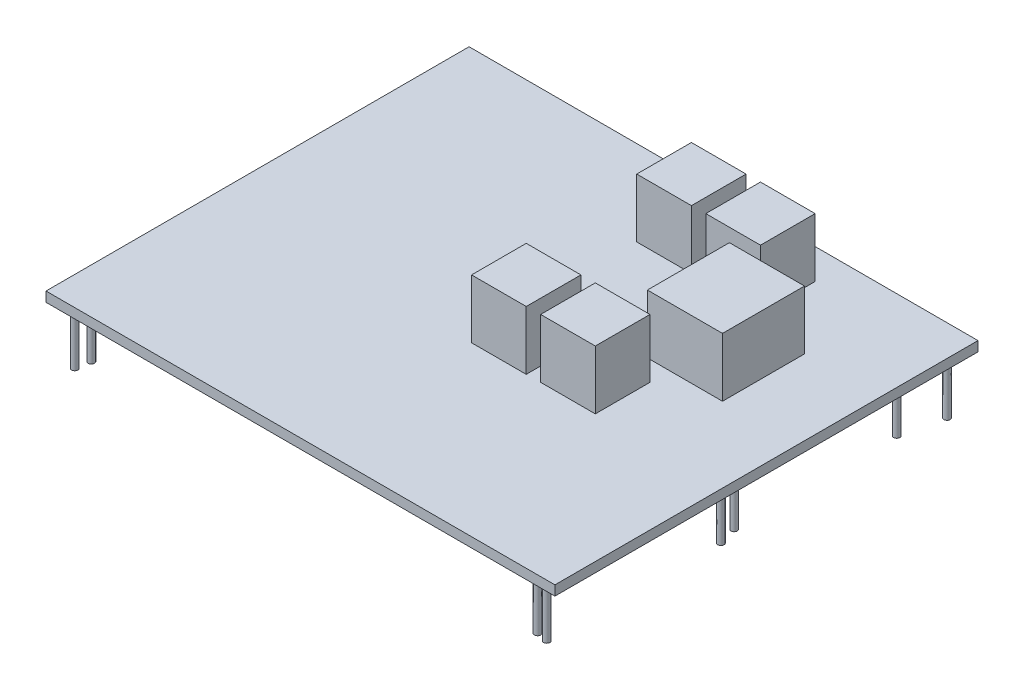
SolidWorks part; units mm, degrees
ref_plane "Front Plane" through (0, 0, 0) normal (0, 0, 1) x (1, 0, 0)
ref_plane "Top Plane" through (0, 0, 0) normal (0, 1, 0) x (1, 0, 0)
ref_plane "Right Plane" through (0, 0, 0) normal (1, 0, 0) x (0, 0, -1)
sketch "Sketch2" plane through (0, 0, 0) normal (0, 1, 0) x (1, 0, 0)
  line L1 (-326.5722, 108.1905) -> (-66.8622, 108.1905)
  line L2 (-326.5722, 108.1905) -> (-326.5722, -107.7095)
  line L3 (-326.5722, -107.7095) -> (-66.8622, -107.7095)
  line L4 (-66.8622, 108.1905) -> (-66.8622, -107.7095)
extrude "Boss-Extrude1" add sketch "Sketch2" along normal blind 5
sketch "Sketch1" plane through (0, 0, 0) normal (0, 1, 0) x (1, 0, 0)
  line L0 (-326.5722, 108.1905) -> (-66.8622, 108.1905) construction
  line L1 (-326.5722, 108.1905) -> (-326.5722, -107.7095) construction
  line L2 (-326.5722, -107.7095) -> (-66.8622, -107.7095) construction
  line L3 (-66.8622, 108.1905) -> (-66.8622, -107.7095) construction
  line L4 (-326.5722, 108.1905) -> (-66.8622, -107.7095) construction
  line L5 (-326.5722, -107.7095) -> (-66.8622, 108.1905) construction
  circle A0 centre (-320.0922, 101.1705) radius 1.6
  circle A1 centre (-312.8522, 99.8505) radius 1.6
  circle A2 centre (-318.8322, -92.3095) radius 1.6
  circle A3 centre (-320.1022, -99.4895) radius 1.6
  circle A4 centre (-177.8622, -34.3995) radius 1.6
  circle A5 centre (-170.2422, -34.3995) radius 1.6
  circle A6 centre (-104.3822, -25.1495) radius 1.6
  circle A7 centre (-216.1422, -6.7695) radius 1.6
  circle A8 centre (-77.9922, -11.8595) radius 1.6
  circle A9 centre (-80.7022, -2.3895) radius 1.6
  circle A10 centre (-84.9022, -98.5295) radius 1.6
  circle A11 centre (-79.2598, -99.4895) radius 1.6
  circle A12 centre (-104.3722, 71.8805) radius 1.6
  circle A13 centre (-80.5422, 80.4105) radius 1.6
  circle A14 centre (-75.6222, 101.1705) radius 1.6
  circle A15 centre (-224.8422, 89.7805) radius 1.6
  point P0 (123.4319, 71.2688)
  point P1 (-196.7172, 0.2405)
  dimension "D3" = 3.2
  dimension "D1" = 215.9
  dimension "D2" = 259.71
  dimension "D4" = 6.48
  dimension "D5" = 7.24
  dimension "D6" = 111
  dimension "D7" = 103.38
  dimension "D8" = 18.04
  dimension "D9" = 12.3976
  dimension "D10" = 37.52
  dimension "D11" = 11.13
  dimension "D12" = 13.84
  dimension "D13" = 110.43
  dimension "D14" = 101.73
  dimension "D15" = 7.74
  dimension "D16" = 6.47
  dimension "D17" = 37.51
  dimension "D18" = 13.68
  dimension "D19" = 8.76
  dimension "D20" = 15.4
  dimension "D21" = 8.22
  dimension "D22" = 100.94
  dimension "D23" = 7.02
  dimension "D24" = 8.34
  dimension "D25" = 18.41
  dimension "D26" = 36.31
  dimension "D27" = 27.78
  dimension "D28" = 7.02
  dimension "D29" = 8.22
  dimension "D30" = 9.18
  dimension "D31" = 73.31
  dimension "D32" = 73.31
  dimension "D33" = 82.56
  dimension "D34" = 105.32
  dimension "D35" = 95.85
extrude "Boss-Extrude2" add sketch "Sketch1" against normal blind 30
sketch "fans" plane through (0, 5, 0) normal (0, 1, 0) x (1, 0, 0)
  line L0 (-160.0056, 6.041) -> (-132.1047, 6.041)
  line L1 (-143.5588, 58.0246) -> (-105.2318, 58.0246)
  line L2 (-143.5588, 58.0246) -> (-143.5588, 16.1734)
  line L3 (-143.5588, 16.1734) -> (-105.2318, 16.1734)
  line L4 (-105.2318, 58.0246) -> (-105.2318, 16.1734)
  line L5 (-195.1019, 5.8941) -> (-167.201, 5.8941)
  line L6 (-195.1019, 5.8941) -> (-195.1019, -22.0067)
  line L7 (-195.1019, -22.0067) -> (-167.201, -22.0067)
  line L8 (-167.201, 5.8941) -> (-167.201, -22.0067)
  line L9 (-160.0056, 6.041) -> (-160.0056, -21.8599)
  line L10 (-160.0056, -21.8599) -> (-132.1047, -21.8599)
  line L11 (-132.1047, 6.041) -> (-132.1047, -21.8599)
  line L12 (-162.4285, 92.7538) -> (-134.5277, 92.7538)
  line L13 (-197.5248, 92.607) -> (-169.624, 92.607)
  line L14 (-197.5248, 92.607) -> (-197.5248, 64.7061)
  line L15 (-197.5248, 64.7061) -> (-169.624, 64.7061)
  line L16 (-169.624, 92.607) -> (-169.624, 64.7061)
  line L17 (-162.4285, 92.7538) -> (-162.4285, 64.853)
  line L18 (-162.4285, 64.853) -> (-134.5277, 64.853)
  line L19 (-134.5277, 92.7538) -> (-134.5277, 64.853)
  point P8 (-190.2559, -30.8175)
extrude "Boss-Extrude3" add sketch "fans" along normal blind 30
